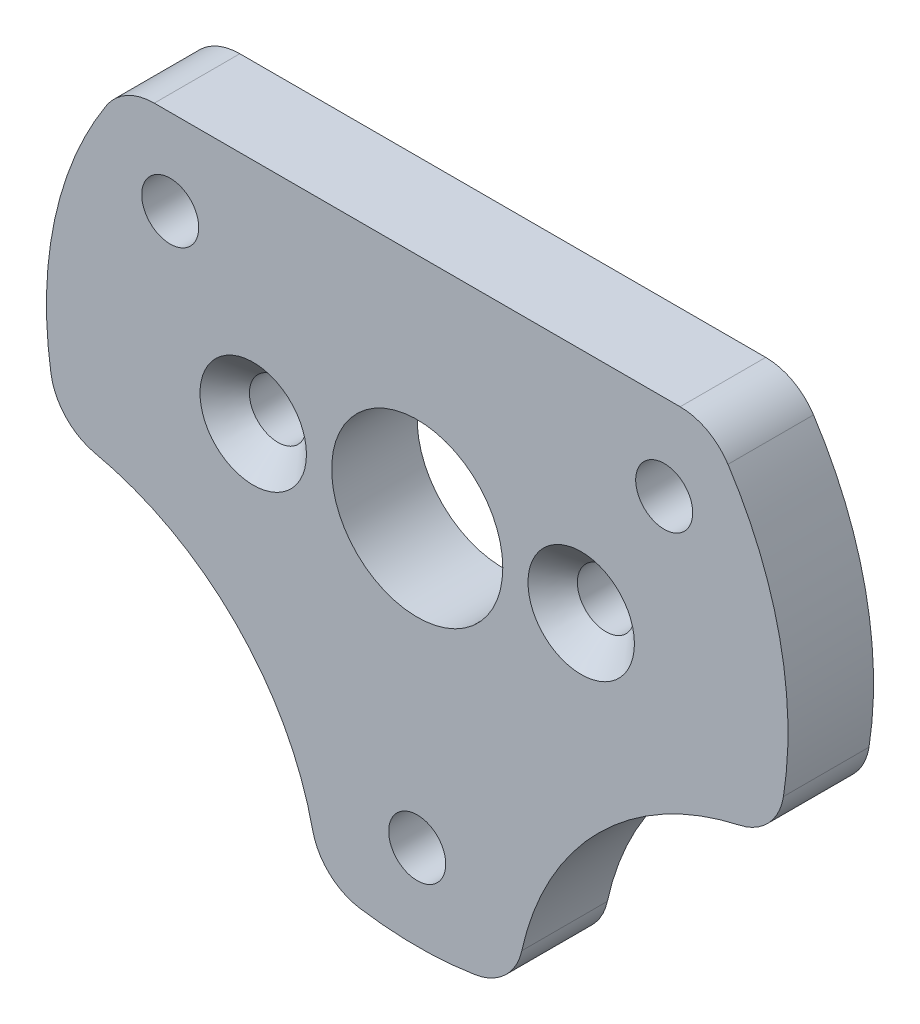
SolidWorks part; units mm, degrees
ref_plane "前视基准面" through (0, 0, 0) normal (0, 0, 1) x (1, 0, 0)
ref_plane "上视基准面" through (0, 0, 0) normal (0, 1, 0) x (1, 0, 0)
ref_plane "右视基准面" through (0, 0, 0) normal (1, 0, 0) x (0, 0, -1)
sketch "草图1" plane through (0, 0, 0) normal (0, 0, 1) x (1, 0, 0)
  line L0 (0, 0) -> (0, 24.8867) construction
  line L1 (-10.247, 8) -> (10.247, 8)
  line L2 (0, 0) -> (0, -15.4904) construction
  line L3 (-13, 0) -> (13, 0) construction
  arc A0 (-10.247, 8) -> (10.247, 8) centre (0, 0) ccw
  circle A1 centre (0, 0) radius 10 construction
  circle A2 centre (0, -10) radius 1
  circle A3 centre (-8.6603, 5) radius 1
  circle A4 centre (8.6603, 5) radius 1
  circle A5 centre (-5.75, 0) radius 1
  circle A6 centre (5.75, 0) radius 1
  circle A7 centre (0, 0) radius 3
  point P16 (0, 0)
  dimension "D1" = 13
  dimension "D3" = 20
  dimension "D4" = 2
  dimension "D6" = 2
  dimension "D8" = 6
  dimension "D2" = 8
  dimension "D7" = 11.5
  dimension "D5" = 3
extrude "凸台-拉伸1" add sketch "草图1" along normal blind 3
sketch "草图2" plane through (0, 0, 3) normal (0, 0, 1) x (1, 0, 0)
  line L0 (0, 0) -> (-12.6952, -12.6952) construction
  line L1 (0, 0) -> (0, -17.9956) construction
  arc A0 (-12.5266, -3.4764) -> (-3.4764, -12.5266) centre (-13.435, -13.435) cw
  arc A1 (-10.247, 8) -> (10.247, 8) centre (0, 0) ccw construction
  arc A2 (-12.5266, -3.4764) -> (-3.4764, -12.5266) centre (0, 0) ccw
  arc A3 (12.5266, -3.4764) -> (3.4764, -12.5266) centre (13.435, -13.435) ccw
  arc A4 (12.5266, -3.4764) -> (3.4764, -12.5266) centre (0, 0) cw
  dimension "D2" = 10
  dimension "D1" = 45
  dimension "D3" = 19
extrude "切除-拉伸1" cut sketch "草图2" against normal blind 10
fillet "圆角1" radius 2 6 edges at (-10.247, 8, 1.5) (10.247, 8, 1.5) (12.5266, -3.4764, 1.5) (3.4764, -12.5266, 1.5) (-3.4764, -12.5266, 1.5) (-12.5266, -3.4764, 1.5)
chamfer "倒角1" distance 0.866 angle 45 2 edges at (4.75, 0, 3) (-4.75, 0, 3)
